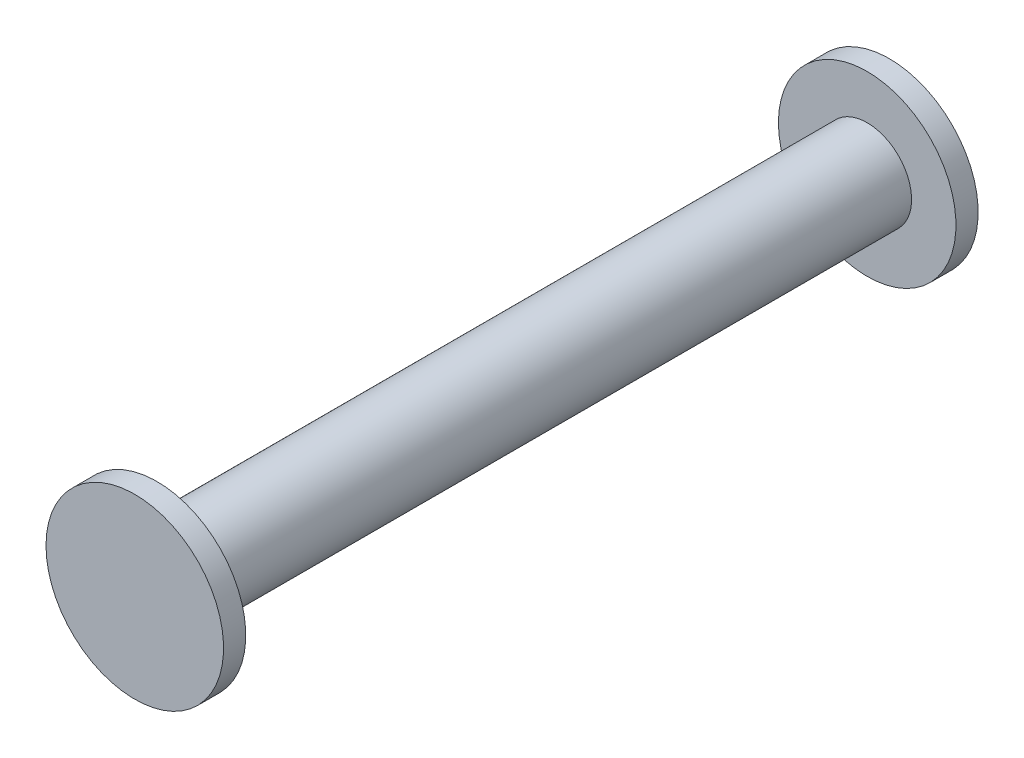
SolidWorks part; units mm, degrees
ref_plane "Plan de face" through (0, 0, 0) normal (0, 0, 1) x (1, 0, 0)
ref_plane "Plan de dessus" through (0, 0, 0) normal (0, 1, 0) x (1, 0, 0)
ref_plane "Plan de droite" through (0, 0, 0) normal (1, 0, 0) x (0, 0, -1)
sketch "Esquisse1" plane through (0, 0, 0) normal (0, 1, 0) x (1, 0, 0)
  line L0 (0, 31.3647) -> (0, -30.8609) construction
  line L1 (0, 17) -> (2, 17)
  line L2 (2, 17) -> (2, 16.5)
  line L3 (2, 16.5) -> (1, 16.5)
  line L4 (1, 16.5) -> (1, 0.5)
  line L5 (1, 0.5) -> (2, 0.5)
  line L6 (2, 0.5) -> (2, 0)
  line L7 (2, 0) -> (0, 0)
  line L8 (0, 17) -> (0, 0)
  dimension "D1" = 0.5
  dimension "D2" = 2
  dimension "D3" = 2
  dimension "D4" = 16
revolve "Révolution1" add sketch "Esquisse1" angle 360 about L0
